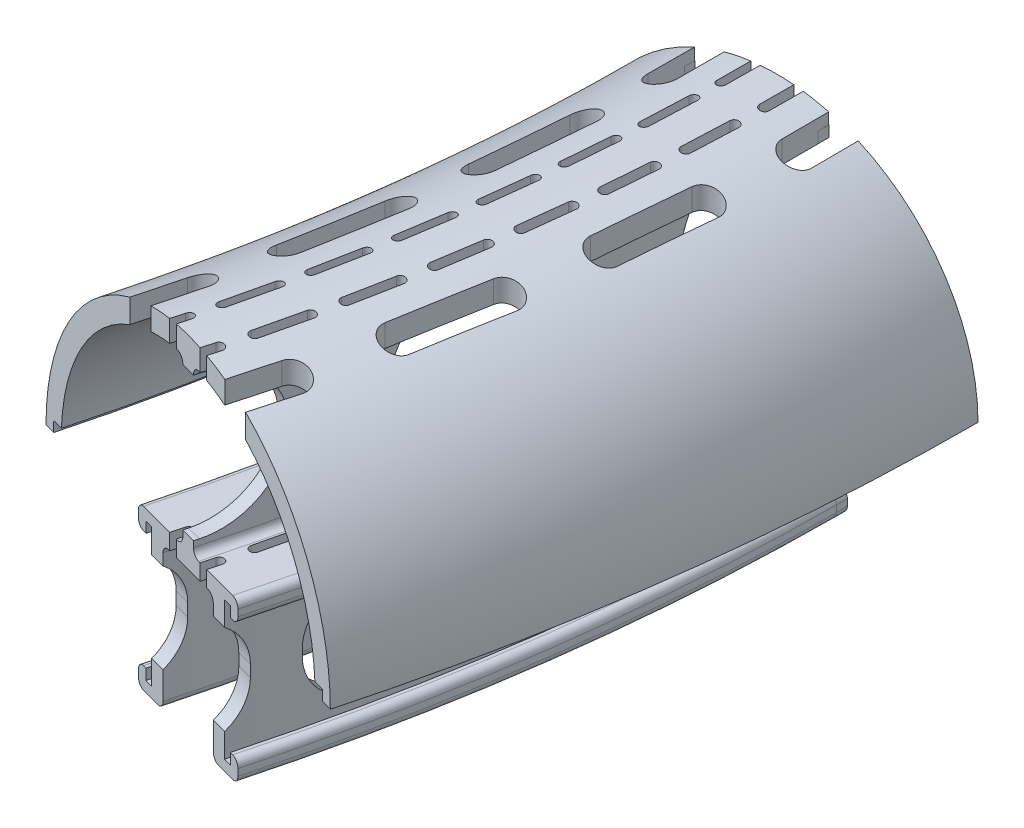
SolidWorks part; units mm, degrees
ref_plane "Спереди" through (0, 0, 0) normal (0, 0, 1) x (1, 0, 0)
ref_plane "Сверху" through (0, 0, 0) normal (0, 1, 0) x (1, 0, 0)
ref_plane "Справа" through (0, 0, 0) normal (1, 0, 0) x (0, 0, -1)
sketch "Эскиз1" plane through (0, 0, 0) normal (0, 0, 1) x (1, 0, 0)
  line L29 (145.55, 0.25) -> (146.15, 0.25)
  line L31 (145.55, -10.05) -> (146.15, -10.05)
  line L33 (145.3, -0.55) -> (145.55, -0.55)
  line L35 (145.3, -9.25) -> (145.55, -9.25)
  line L40 (145.55, 0.25) -> (145.55, -0.55)
  line L46 (144.75, -10.3) -> (144.75, -9.8)
  line L50 (144.75, 0) -> (144.75, 0.5)
  line L51 (145.55, -9.25) -> (145.55, -10.05)
  line L52 (146.15, 0.25) -> (146.15, -10.05)
  line L56 (135.8213, 0.7768) -> (136.6225, 0.7768)
  line L58 (135, 0) -> (135.8, 0)
  line L62 (164.2, 0) -> (165, 0)
  line L63 (163.3775, 0.7768) -> (164.1787, 0.7768)
  line L65 (0, 44.1102) -> (0, 0) construction
  line L68 (149.4347, 12.8015) -> (149.4347, 1.6)
  line L71 (145.3, 1.05) -> (148.8847, 1.05)
  line L72 (147.9, -0.15) -> (152.1, -0.15)
  line L73 (147.35, -0.7) -> (147.35, -10.3)
  line L74 (145.3, -10.85) -> (146.8, -10.85)
  line L75 (150, 12.0049) -> (150, -5.7785) construction
  line L76 (154.7, -10.85) -> (153.2, -10.85)
  line L77 (152.65, -0.7) -> (152.65, -10.3)
  line L78 (154.7, 1.05) -> (151.1153, 1.05)
  line L79 (150.5653, 12.8015) -> (150.5653, 1.6)
  line L80 (153.85, 0.25) -> (153.85, -10.05)
  line L81 (154.45, -9.25) -> (154.45, -10.05)
  line L82 (155.25, 0) -> (155.25, 0.5)
  line L83 (155.25, -10.3) -> (155.25, -9.8)
  line L84 (154.45, 0.25) -> (154.45, -0.55)
  line L85 (154.7, -9.25) -> (154.45, -9.25)
  line L86 (154.7, -0.55) -> (154.45, -0.55)
  line L87 (154.45, -10.05) -> (153.85, -10.05)
  line L88 (154.45, 0.25) -> (153.85, 0.25)
  arc A0 (165, 0) -> (135, 0) centre (150, 0) ccw
  arc A2 (148.837, 13.3494) -> (136.6225, 0.7768) centre (150, 0) ccw
  arc A3 (144.75, 0.5) -> (145.3, 1.05) centre (145.3, 0.5) cw
  arc A4 (145.3, -0.55) -> (144.75, 0) centre (145.3, 0) cw
  arc A7 (145.3, -9.25) -> (144.75, -9.8) centre (145.3, -9.8) ccw
  arc A10 (145.3, -10.85) -> (144.75, -10.3) centre (145.3, -10.3) cw
  arc A15 (163.3775, 0.7768) -> (151.163, 13.3494) centre (150, 0) ccw
  arc A18 (135.8213, 0.7768) -> (135.8, 0) centre (150, 0) ccw
  arc A19 (164.2, 0) -> (164.1787, 0.7768) centre (150, 0) ccw
  arc A20 (164.2, 0) -> (150.6174, 14.1866) centre (150, 0) ccw construction
  arc A21 (163.4, 0) -> (150.5826, 13.3873) centre (150, 0) ccw construction
  arc A22 (149.4174, 13.3873) -> (136.6, 0) centre (150, 0) ccw construction
  arc A23 (149.3826, 14.1866) -> (135.8, 0) centre (150, 0) ccw construction
  arc A24 (148.837, 13.3494) -> (149.4347, 12.8015) centre (148.8847, 12.8015) cw
  arc A25 (150.5653, 12.8015) -> (151.163, 13.3494) centre (151.1153, 12.8015) cw
  arc A28 (147.35, -10.3) -> (146.8, -10.85) centre (146.8, -10.3) cw
  arc A29 (148.8847, 1.05) -> (149.4347, 1.6) centre (148.8847, 1.6) ccw
  arc A30 (147.9, -0.15) -> (147.35, -0.7) centre (147.9, -0.7) ccw
  arc A31 (152.1, -0.15) -> (152.65, -0.7) centre (152.1, -0.7) cw
  arc A32 (151.1153, 1.05) -> (150.5653, 1.6) centre (151.1153, 1.6) cw
  arc A33 (152.65, -10.3) -> (153.2, -10.85) centre (153.2, -10.3) ccw
  arc A34 (154.7, -10.85) -> (155.25, -10.3) centre (154.7, -10.3) ccw
  arc A35 (154.7, -9.25) -> (155.25, -9.8) centre (154.7, -9.8) cw
  arc A36 (154.7, -0.55) -> (155.25, 0) centre (154.7, 0) ccw
  arc A37 (155.25, 0.5) -> (154.7, 1.05) centre (154.7, 0.5) ccw
  point P39 (144.75, -0.55)
  point P58 (146.15, -7.55)
  point P60 (153.85, -7.55)
  point P61 (150, -0.15)
  dimension "D1" = 30
  dimension "D3" = 1.6
  dimension "D13" = 0.8
  dimension "D14" = 4.2
  dimension "D17" = 0.55
  dimension "D4" = 1.2
  dimension "D6" = 0.55
  dimension "D2" = 150
  dimension "D5" = 1.2
  dimension "D7" = 10.3
  dimension "D8" = 0.8
  dimension "D9" = 0.6
  dimension "D10" = 0.8
  dimension "D11" = 0.8
  dimension "D12" = 0.8
  dimension "D15" = 0.8
revolve "Повернуть1" add sketch "Эскиз1" angle 15 about L65
sketch "Эскиз2" plane through (0, 0, 0) normal (0, 0, 1) x (1, 0, 0)
  line L0 (0, 24.166) -> (0, -25.4144) construction
  circle A0 centre (150, 0) radius 14.2
revolve "Вырез-Повернуть1" cut sketch "Эскиз2" angle 0.3 about L0
sketch "Эскиз3" plane through (0, 0, 0) normal (-0.2588, 0, 0.9659) x (0.9659, 0, 0.2588)
  line L0 (0, 58.5351) -> (0, -22.4397) construction
  line L31 (135, 0) -> (135.8, 0)
  line L32 (135.8213, 0.7768) -> (136.6225, 0.7768)
  line L33 (149.4347, 12.8015) -> (149.4347, 1.6)
  line L34 (148.8847, 1.05) -> (145.3, 1.05)
  line L35 (144.75, 0.5) -> (144.75, 0)
  line L36 (145.3, -0.55) -> (145.55, -0.55)
  line L37 (145.55, -0.55) -> (145.55, 0.25)
  line L38 (145.55, 0.25) -> (146.15, 0.25)
  line L39 (146.15, 0.25) -> (146.15, -10.05)
  line L40 (146.15, -10.05) -> (145.55, -10.05)
  line L41 (145.55, -10.05) -> (145.55, -9.25)
  line L42 (145.55, -9.25) -> (145.3, -9.25)
  line L43 (144.75, -9.8) -> (144.75, -10.3)
  line L44 (145.3, -10.85) -> (146.8, -10.85)
  line L45 (147.35, -10.3) -> (147.35, -0.7)
  line L46 (147.9, -0.15) -> (152.1, -0.15)
  line L47 (152.65, -0.7) -> (152.65, -10.3)
  line L48 (153.2, -10.85) -> (154.7, -10.85)
  line L49 (155.25, -10.3) -> (155.25, -9.8)
  line L50 (154.7, -9.25) -> (154.45, -9.25)
  line L51 (154.45, -9.25) -> (154.45, -10.05)
  line L52 (154.45, -10.05) -> (153.85, -10.05)
  line L53 (153.85, -10.05) -> (153.85, 0.25)
  line L54 (153.85, 0.25) -> (154.45, 0.25)
  line L55 (154.45, 0.25) -> (154.45, -0.55)
  line L56 (154.45, -0.55) -> (154.7, -0.55)
  line L57 (155.25, 0) -> (155.25, 0.5)
  line L58 (154.7, 1.05) -> (151.1153, 1.05)
  line L59 (150.5653, 1.6) -> (150.5653, 12.8015)
  line L60 (163.3775, 0.7768) -> (164.1787, 0.7768)
  line L61 (164.2, 0) -> (165, 0)
  line L63 (135.8213, 0.7768) -> (136.6225, 0.7768)
  line L64 (149.4347, 12.8015) -> (149.4347, 1.6)
  line L65 (148.8847, 1.05) -> (145.3, 1.05)
  line L66 (144.75, 0.5) -> (144.75, 0)
  line L67 (145.3, -0.55) -> (145.55, -0.55)
  line L68 (145.55, -0.55) -> (145.55, 0.25)
  line L69 (145.55, 0.25) -> (146.15, 0.25)
  line L70 (146.15, 0.25) -> (146.15, -10.05)
  line L71 (146.15, -10.05) -> (145.55, -10.05)
  line L72 (145.55, -10.05) -> (145.55, -9.25)
  line L73 (145.55, -9.25) -> (145.3, -9.25)
  line L74 (144.75, -9.8) -> (144.75, -10.3)
  line L75 (145.3, -10.85) -> (146.8, -10.85)
  line L76 (147.35, -10.3) -> (147.35, -0.7)
  line L77 (147.9, -0.15) -> (152.1, -0.15)
  line L78 (152.65, -0.7) -> (152.65, -10.3)
  line L79 (153.2, -10.85) -> (154.7, -10.85)
  line L80 (155.25, -10.3) -> (155.25, -9.8)
  line L81 (154.7, -9.25) -> (154.45, -9.25)
  line L82 (154.45, -9.25) -> (154.45, -10.05)
  line L83 (154.45, -10.05) -> (153.85, -10.05)
  line L84 (153.85, -10.05) -> (153.85, 0.25)
  line L85 (153.85, 0.25) -> (154.45, 0.25)
  line L86 (154.45, 0.25) -> (154.45, -0.55)
  line L87 (154.45, -0.55) -> (154.7, -0.55)
  line L88 (155.25, 0) -> (155.25, 0.5)
  line L89 (154.7, 1.05) -> (151.1153, 1.05)
  line L90 (150.5653, 1.6) -> (150.5653, 12.8015)
  line L91 (163.3775, 0.7768) -> (164.1787, 0.7768)
  arc A0 (164.1787, 0.7768) -> (135.8213, 0.7768) centre (150, 0) ccw
  arc A21 (165, 0) -> (135, 0) centre (150, 0) ccw
  arc A22 (135.8213, 0.7768) -> (135.8, 0) centre (150, 0) ccw
  arc A23 (148.837, 13.3494) -> (136.6225, 0.7768) centre (150, 0) ccw
  arc A24 (149.4347, 12.8015) -> (148.837, 13.3494) centre (148.8847, 12.8015) ccw
  arc A25 (148.8847, 1.05) -> (149.4347, 1.6) centre (148.8847, 1.6) ccw
  arc A26 (145.3, 1.05) -> (144.75, 0.5) centre (145.3, 0.5) ccw
  arc A27 (144.75, 0) -> (145.3, -0.55) centre (145.3, 0) ccw
  arc A28 (145.3, -9.25) -> (144.75, -9.8) centre (145.3, -9.8) ccw
  arc A29 (144.75, -10.3) -> (145.3, -10.85) centre (145.3, -10.3) ccw
  arc A30 (146.8, -10.85) -> (147.35, -10.3) centre (146.8, -10.3) ccw
  arc A31 (147.9, -0.15) -> (147.35, -0.7) centre (147.9, -0.7) ccw
  arc A32 (152.65, -0.7) -> (152.1, -0.15) centre (152.1, -0.7) ccw
  arc A33 (152.65, -10.3) -> (153.2, -10.85) centre (153.2, -10.3) ccw
  arc A34 (154.7, -10.85) -> (155.25, -10.3) centre (154.7, -10.3) ccw
  arc A35 (155.25, -9.8) -> (154.7, -9.25) centre (154.7, -9.8) ccw
  arc A36 (154.7, -0.55) -> (155.25, 0) centre (154.7, 0) ccw
  arc A37 (155.25, 0.5) -> (154.7, 1.05) centre (154.7, 0.5) ccw
  arc A38 (150.5653, 1.6) -> (151.1153, 1.05) centre (151.1153, 1.6) ccw
  arc A39 (151.163, 13.3494) -> (150.5653, 12.8015) centre (151.1153, 12.8015) ccw
  arc A40 (163.3775, 0.7768) -> (151.163, 13.3494) centre (150, 0) ccw
  arc A41 (164.2, 0) -> (164.1787, 0.7768) centre (150, 0) ccw
  arc A44 (148.837, 13.3494) -> (136.6225, 0.7768) centre (150, 0) ccw
  arc A45 (149.4347, 12.8015) -> (148.837, 13.3494) centre (148.8847, 12.8015) ccw
  arc A46 (148.8847, 1.05) -> (149.4347, 1.6) centre (148.8847, 1.6) ccw
  arc A47 (145.3, 1.05) -> (144.75, 0.5) centre (145.3, 0.5) ccw
  arc A48 (144.75, 0) -> (145.3, -0.55) centre (145.3, 0) ccw
  arc A49 (145.3, -9.25) -> (144.75, -9.8) centre (145.3, -9.8) ccw
  arc A50 (144.75, -10.3) -> (145.3, -10.85) centre (145.3, -10.3) ccw
  arc A51 (146.8, -10.85) -> (147.35, -10.3) centre (146.8, -10.3) ccw
  arc A52 (147.9, -0.15) -> (147.35, -0.7) centre (147.9, -0.7) ccw
  arc A53 (152.65, -0.7) -> (152.1, -0.15) centre (152.1, -0.7) ccw
  arc A54 (152.65, -10.3) -> (153.2, -10.85) centre (153.2, -10.3) ccw
  arc A55 (154.7, -10.85) -> (155.25, -10.3) centre (154.7, -10.3) ccw
  arc A56 (155.25, -9.8) -> (154.7, -9.25) centre (154.7, -9.8) ccw
  arc A57 (154.7, -0.55) -> (155.25, 0) centre (154.7, 0) ccw
  arc A58 (155.25, 0.5) -> (154.7, 1.05) centre (154.7, 0.5) ccw
  arc A59 (150.5653, 1.6) -> (151.1153, 1.05) centre (151.1153, 1.6) ccw
  arc A60 (151.163, 13.3494) -> (150.5653, 12.8015) centre (151.1153, 12.8015) ccw
  arc A61 (163.3775, 0.7768) -> (151.163, 13.3494) centre (150, 0) ccw
  dimension "D1" = 0
revolve "Повернуть2" add sketch "Эскиз3" angle 0.3 about L0
sketch "Эскиз5" plane through (0, -0.15, 0) normal (0, -1, 0) x (1, 0, 0)
  line L0 (144.0175, 33.6654) -> (144.9764, 33.8895) construction
  line L1 (144.9764, 33.8895) -> (147.1484, 34.3972) construction
  line L2 (147.1484, 34.3972) -> (146.0624, 34.1434) construction
  line L5 (146.0624, 34.1434) -> (146.389, 32.7464) construction
  line L6 (144.0986, 35.4815) -> (144.8953, 32.0734) construction
  line L11 (144.4394, 35.5612) -> (145.2361, 32.1531)
  line L14 (143.7578, 35.4018) -> (144.5545, 31.9937)
  line L15 (147.2295, 36.2134) -> (148.0262, 32.8053) construction
  line L18 (146.8887, 36.1337) -> (147.6854, 32.7256)
  line L21 (147.5703, 36.2931) -> (148.367, 32.8849)
  line L22 (145.1756, 28.2568) -> (146.1422, 28.445) construction
  line L25 (146.1422, 28.445) -> (148.3317, 28.8711) construction
  line L28 (148.3317, 28.8711) -> (147.2369, 28.6581) construction
  line L29 (147.2369, 28.6581) -> (147.511, 27.2499) construction
  line L32 (145.3246, 30.0687) -> (145.9933, 26.6332) construction
  line L35 (145.6681, 30.1355) -> (146.3368, 26.7)
  line L36 (144.981, 30.0018) -> (145.6497, 26.5663)
  line L39 (148.4806, 30.683) -> (149.1493, 27.2474) construction
  line L42 (148.1371, 30.6161) -> (148.8058, 27.1806)
  line L43 (148.8242, 30.7498) -> (149.4929, 27.3143)
  line L46 (146.1307, 22.8088) -> (147.1036, 22.9607) construction
  line L49 (147.1036, 22.9607) -> (149.3075, 23.3047) construction
  line L50 (149.3075, 23.3047) -> (148.2055, 23.1327) construction
  line L53 (148.2055, 23.1327) -> (148.4268, 21.7152) construction
  line L56 (146.3472, 24.6138) -> (146.887, 21.1557) construction
  line L57 (146.6931, 24.6678) -> (147.2328, 21.2096)
  line L60 (146.0014, 24.5598) -> (146.5412, 21.1017)
  line L63 (149.5241, 25.1096) -> (150.0638, 21.6515) construction
  line L64 (149.1782, 25.0557) -> (149.718, 21.5975)
  line L67 (149.8699, 25.1636) -> (150.4096, 21.7055)
  line L70 (142.658, 39.0268) -> (143.6079, 39.2867) construction
  line L71 (142.6712, 40.8447) -> (143.5947, 37.4688) construction
  line L72 (143.0088, 40.9371) -> (143.9323, 37.5611)
  line L73 (142.3336, 40.7524) -> (143.2571, 37.3764)
  line L74 (143.6079, 39.2867) -> (145.7594, 39.8753) construction
  line L75 (145.7594, 39.8753) -> (144.6836, 39.581) construction
  line L76 (144.6836, 39.581) -> (145.0622, 38.1972) construction
  line L77 (145.7725, 41.6931) -> (146.6961, 38.3172) construction
  line L78 (145.4349, 41.6008) -> (146.3585, 38.2248)
  line L79 (146.1101, 41.7855) -> (147.0336, 38.4096)
  line L80 (146.8813, 17.3288) -> (147.8593, 17.4442) construction
  line L81 (147.8593, 17.4442) -> (150.0745, 17.7056) construction
  line L82 (150.0745, 17.7056) -> (148.9669, 17.5749) construction
  line L83 (148.9669, 17.5749) -> (149.1349, 16.1502) construction
  line L84 (147.1652, 19.1245) -> (147.5753, 15.6486) construction
  line L87 (147.5128, 19.1655) -> (147.9229, 15.6896)
  line L90 (146.8177, 19.0835) -> (147.2277, 15.6076)
  line L91 (150.3584, 19.5012) -> (150.7685, 16.0253) construction
  line L92 (150.0108, 19.4602) -> (150.4209, 15.9843)
  line L93 (150.706, 19.5422) -> (151.1161, 16.0663)
  line L94 (147.4265, 11.8247) -> (148.4081, 11.9034) construction
  line L97 (148.4081, 11.9034) -> (150.6315, 12.0817) construction
  line L100 (150.6315, 12.0817) -> (149.5198, 11.9926) construction
  line L101 (149.5198, 11.9926) -> (149.6345, 10.5625) construction
  line L102 (147.7774, 13.6084) -> (148.0572, 10.1196) construction
  line L103 (148.1263, 13.6364) -> (148.4061, 10.1476)
  line L104 (147.4285, 13.5804) -> (147.7084, 10.0916)
  line L107 (150.9824, 13.8655) -> (151.2622, 10.3767) construction
  line L110 (150.6335, 13.8375) -> (150.9134, 10.3487)
  line L111 (151.3313, 13.8935) -> (151.6111, 10.4047)
  line L112 (147.7656, 6.3039) -> (148.7494, 6.3459) construction
  line L113 (148.7494, 6.3459) -> (150.978, 6.441) construction
  line L114 (150.978, 6.441) -> (149.8637, 6.3934) construction
  line L117 (149.8637, 6.3934) -> (149.9248, 4.9601) construction
  line L120 (148.1829, 8.0733) -> (148.3321, 4.5765) construction
  line L121 (148.5326, 8.0883) -> (148.6818, 4.5914)
  line L122 (147.8332, 8.0584) -> (147.9824, 4.5616)
  line L123 (151.3953, 8.2104) -> (151.5445, 4.7136) construction
  line L124 (151.0456, 8.1955) -> (151.1948, 4.6986)
  line L127 (151.745, 8.2253) -> (151.8941, 4.7285)
  line L130 (147.898, 0.7744) -> (148.8827, 0.7796) construction
  line L131 (148.8827, 0.7796) -> (151.1132, 0.7912) construction
  line L132 (151.1132, 0.7912) -> (149.9979, 0.7854) construction
  line L133 (149.9979, 0.7854) -> (150.0055, -0.6492) construction
  line L134 (148.3812, 2.527) -> (148.3995, -0.973) construction
  line L137 (148.7312, 2.5288) -> (148.7495, -0.9712)
  line L140 (148.0312, 2.5251) -> (148.0495, -0.9748)
  line L141 (151.5964, 2.5438) -> (151.6147, -0.9562) construction
  line L142 (151.2464, 2.542) -> (151.2647, -0.958)
  line L143 (151.9464, 2.5456) -> (151.9647, -0.9543)
  arc A40 (152.0979, 0.7964) -> (146.7092, 40.1351) centre (0, 0) ccw construction
  arc A41 (147.898, 0.7744) -> (142.658, 39.0268) centre (0, 0) ccw construction
  arc A42 (152.0979, 0.7964) -> (146.7092, 40.1351) centre (0, 0) ccw construction
  arc A43 (147.898, 0.7744) -> (142.658, 39.0268) centre (0, 0) ccw construction
  arc A44 (151.1132, 0.7912) -> (145.7594, 39.8753) centre (0, 0) ccw construction
  arc A45 (148.8827, 0.7796) -> (143.6079, 39.2867) centre (0, 0) ccw construction
  arc A46 (151.1132, 0.7912) -> (145.7594, 39.8753) centre (0, 0) ccw construction
  arc A47 (148.8827, 0.7796) -> (143.6079, 39.2867) centre (0, 0) ccw construction
  arc A48 (143.0088, 40.9371) -> (142.3336, 40.7524) centre (142.6712, 40.8447) ccw
  arc A49 (143.2571, 37.3764) -> (143.9323, 37.5611) centre (143.5947, 37.4688) ccw
  arc A50 (145.4349, 41.6008) -> (146.1101, 41.7855) centre (145.7725, 41.6931) cw
  arc A51 (147.0336, 38.4096) -> (146.3585, 38.2248) centre (146.6961, 38.3172) cw
  arc A84 (144.4394, 35.5612) -> (143.7578, 35.4018) centre (144.0986, 35.4815) ccw
  arc A85 (144.5545, 31.9937) -> (145.2361, 32.1531) centre (144.8953, 32.0734) ccw
  arc A86 (146.8887, 36.1337) -> (147.5703, 36.2931) centre (147.2295, 36.2134) cw
  arc A87 (148.367, 32.8849) -> (147.6854, 32.7256) centre (148.0262, 32.8053) cw
  arc A88 (145.6681, 30.1355) -> (144.981, 30.0018) centre (145.3246, 30.0687) ccw
  arc A89 (145.6497, 26.5663) -> (146.3368, 26.7) centre (145.9933, 26.6332) ccw
  arc A90 (148.1371, 30.6161) -> (148.8242, 30.7498) centre (148.4806, 30.683) cw
  arc A91 (149.4929, 27.3143) -> (148.8058, 27.1806) centre (149.1493, 27.2474) cw
  arc A92 (146.6931, 24.6678) -> (146.0014, 24.5598) centre (146.3472, 24.6138) ccw
  arc A93 (146.5412, 21.1017) -> (147.2328, 21.2096) centre (146.887, 21.1557) ccw
  arc A94 (149.1782, 25.0557) -> (149.8699, 25.1636) centre (149.5241, 25.1096) cw
  arc A95 (150.4096, 21.7055) -> (149.718, 21.5975) centre (150.0638, 21.6515) cw
  arc A96 (147.5128, 19.1655) -> (146.8177, 19.0835) centre (147.1652, 19.1245) ccw
  arc A97 (147.2277, 15.6076) -> (147.9229, 15.6896) centre (147.5753, 15.6486) ccw
  arc A98 (150.0108, 19.4602) -> (150.706, 19.5422) centre (150.3584, 19.5012) cw
  arc A99 (151.1161, 16.0663) -> (150.4209, 15.9843) centre (150.7685, 16.0253) cw
  arc A100 (148.1263, 13.6364) -> (147.4285, 13.5804) centre (147.7774, 13.6084) ccw
  arc A101 (147.7084, 10.0916) -> (148.4061, 10.1476) centre (148.0572, 10.1196) ccw
  arc A102 (150.6335, 13.8375) -> (151.3313, 13.8935) centre (150.9824, 13.8655) cw
  arc A103 (151.6111, 10.4047) -> (150.9134, 10.3487) centre (151.2622, 10.3767) cw
  arc A104 (148.5326, 8.0883) -> (147.8332, 8.0584) centre (148.1829, 8.0733) ccw
  arc A105 (147.9824, 4.5616) -> (148.6818, 4.5914) centre (148.3321, 4.5765) ccw
  arc A106 (151.0456, 8.1955) -> (151.745, 8.2253) centre (151.3953, 8.2104) cw
  arc A107 (151.8941, 4.7285) -> (151.1948, 4.6986) centre (151.5445, 4.7136) cw
  arc A108 (148.7312, 2.5288) -> (148.0312, 2.5251) centre (148.3812, 2.527) ccw
  arc A109 (148.0495, -0.9748) -> (148.7495, -0.9712) centre (148.3995, -0.973) ccw
  arc A110 (151.2464, 2.542) -> (151.9464, 2.5456) centre (151.5964, 2.5438) cw
  arc A111 (151.9647, -0.9543) -> (151.2647, -0.958) centre (151.6147, -0.9562) cw
  point P4 (197.2189, 41.8003)
  point P11 (144.497, 33.7775)
  point P20 (147.6279, 34.5093)
  point P24 (195.9197, 47.5186)
  point P29 (198.3512, 36.0465)
  point P32 (145.6589, 28.3509)
  point P36 (199.3157, 30.2623)
  point P42 (148.815, 28.9652)
  point P45 (200.1116, 24.4524)
  point P52 (200.7381, 18.6219)
  point P54 (146.6171, 22.8847)
  point P61 (201.1948, 12.7756)
  point P64 (149.7939, 23.3806)
  point P68 (201.4812, 6.9185)
  point P75 (147.3703, 17.3865)
  point P77 (201.5972, 1.0556)
  point P85 (150.5634, 17.7633)
  point P95 (147.9173, 11.864)
  point P104 (151.1223, 12.1211)
  point P114 (148.2575, 6.3249)
  point P123 (151.4699, 6.462)
  point P133 (148.3903, 0.777)
  point P142 (151.6056, 0.7938)
  point P147 (0, 0)
  point P162 (0, 0)
  point P175 (143.133, 39.1567)
  point P180 (143.133, 39.1567)
  point P185 (146.2343, 40.0052)
  point P344 (152.9355, -0.3433)
  dimension "D4" = 3.5
  dimension "D5" = 0.7
  dimension "D6" = 0
extrude "Вырез-Вытянуть1" cut sketch "Эскиз5" against normal blind 20
ref_plane "Плоскость1" through (0, 2.05, 0) normal (0, 1, 0) x (1, 0, 0)
sketch "Эскиз6" plane through (0, 2.05, 0) normal (0, 1, 0) x (1, 0, 0)
  line L9 (150.6637, -0.6889) -> (149.3332, -0.6819)
  line L14 (150.4756, -7.5578) -> (149.1467, -7.4919)
  line L17 (144.0155, -39.5019) -> (145.2989, -39.853)
  line L18 (150.5632, -0.7884) -> (149.4327, -0.7824) construction
  line L19 (144.1384, -39.4318) -> (145.2289, -39.7301) construction
  line L20 (146.9649, -33.1865) -> (145.6672, -32.8926)
  line L21 (146.8453, -33.2619) -> (145.7427, -33.0122) construction
  line L22 (148.1214, -27.0178) -> (147.0092, -26.815) construction
  line L23 (149.9306, -13.8102) -> (148.8048, -13.7065) construction
  line L24 (150.3807, -7.453) -> (149.2515, -7.397) construction
  line L25 (148.2018, -27.1341) -> (146.8928, -26.8954)
  line L26 (150.0393, -13.7198) -> (148.7144, -13.5978)
  arc A24 (145.2289, -39.7301) -> (150.5632, -0.7884) centre (0, 0) ccw construction
  arc A25 (144.1384, -39.4318) -> (149.4327, -0.7824) centre (0, 0) ccw construction
  arc A26 (145.2289, -39.7301) -> (146.8453, -33.2619) centre (0, 0) ccw construction
  arc A27 (144.1384, -39.4318) -> (145.7427, -33.0122) centre (0, 0) ccw construction
  arc A28 (150.3807, -7.453) -> (150.5632, -0.7884) centre (0, 0) ccw construction
  arc A29 (149.2515, -7.397) -> (149.4327, -0.7824) centre (0, 0) ccw construction
  arc A30 (148.1214, -27.0178) -> (149.9306, -13.8102) centre (0, 0) ccw construction
  arc A31 (147.0092, -26.815) -> (148.8048, -13.7065) centre (0, 0) ccw construction
  arc A32 (149.1467, -7.4919) -> (149.3332, -0.6819) centre (0, 0) ccw
  arc A33 (150.4756, -7.5578) -> (150.6637, -0.6889) centre (0, 0) ccw
  arc A36 (145.2989, -39.853) -> (146.9649, -33.1865) centre (0, 0) ccw
  arc A37 (144.0155, -39.5019) -> (145.6672, -32.8926) centre (0, 0) ccw
  arc A38 (146.8928, -26.8954) -> (148.7144, -13.5978) centre (0, 0) ccw
  arc A39 (148.2018, -27.1341) -> (150.0393, -13.7198) centre (0, 0) ccw
  point P18 (0, 0)
  point P29 (0, 0)
  dimension "D1" = 0.1
extrude "Вырез-Вытянуть3" cut sketch "Эскиз6" along normal blind 10.7
fillet "Скругление1" radius 5.6 8 edges at (147.5473, 12.75, 27.0148) (149.8111, 12.75, 7.5249) (149.8111, 2.05, 7.5249) (147.5473, 2.05, 27.0148) (149.3768, 2.05, 13.6588) (146.3161, 2.05, 33.0395) (149.3768, 12.75, 13.6588) (146.3161, 12.75, 33.0395)
ref_plane "Плоскость2" through (0, -1.15, 0) normal (0, -1, 0) x (-1, 0, 0)
sketch "Эскиз8" plane through (0, -1.15, 0) normal (0, -1, 0) x (-1, 0, 0)
  line L48 (-146.2207, -2.9255) -> (-147.2205, -2.9461) construction
  line L53 (-146.1187, -3.0234) -> (-147.3185, -3.0482)
  line L54 (-153.7134, -6.4819) -> (-152.5145, -6.4313) construction
  line L55 (-153.4397, -11.2285) -> (-152.2429, -11.1409) construction
  line L56 (-153.1635, -14.5177) -> (-151.9689, -14.4045) construction
  line L57 (-152.6418, -19.2431) -> (-151.4512, -19.093) construction
  line L58 (-152.1939, -22.5132) -> (-151.0068, -22.3376) construction
  line L59 (-151.4256, -27.2048) -> (-150.2445, -26.9926) construction
  line L60 (-150.8069, -30.4481) -> (-149.6307, -30.2107) construction
  line L61 (-149.7941, -35.0935) -> (-148.6257, -34.8198) construction
  line L62 (-149.0072, -38.2973) -> (-147.845, -37.9984)
  line L63 (-0.6832, -0.1601) -> (-0.1526, -0.0145)
  line L64 (-0.4482, -0.0905) -> (0, 0)
  line L65 (-1.0818, -0.2534) -> (0, 0)
  line L66 (-1.0818, -0.2534) -> (-0.1526, -0.0145)
  line L67 (-152.6173, -3.1578) -> (-153.8171, -3.1827)
  line L68 (-147.2192, -6.208) -> (-146.0202, -6.1575) construction
  line L69 (-146.957, -10.7541) -> (-145.7602, -10.6665) construction
  line L70 (-146.6925, -13.9044) -> (-145.4979, -13.7911) construction
  line L71 (-146.1929, -18.4299) -> (-145.0023, -18.2798) construction
  line L72 (-145.7639, -21.5617) -> (-144.5768, -21.3861) construction
  line L73 (-145.0281, -26.0549) -> (-143.8471, -25.8426) construction
  line L74 (-144.4355, -29.1617) -> (-143.2592, -28.9243) construction
  line L75 (-143.4655, -33.6108) -> (-142.2971, -33.3371) construction
  line L76 (-142.712, -36.6783) -> (-141.5498, -36.3794)
  line L77 (-153.8175, -6.3862) -> (-152.4187, -6.3272)
  line L78 (-153.5321, -11.3355) -> (-152.1358, -11.2333)
  line L79 (-153.2725, -14.4276) -> (-151.8787, -14.2955)
  line L80 (-152.7285, -19.3549) -> (-151.3395, -19.1797)
  line L81 (-152.3074, -22.4289) -> (-150.9225, -22.224)
  line L82 (-151.5063, -27.321) -> (-150.1284, -27.0733)
  line L83 (-150.9247, -30.3699) -> (-149.5524, -30.0928)
  line L84 (-149.8686, -35.2136) -> (-148.5055, -34.8943)
  line L85 (-148.8854, -38.3693) -> (-147.9169, -38.1202) construction
  line L86 (-152.7193, -3.0599) -> (-153.7191, -3.0806) construction
  line L87 (-147.3233, -6.1123) -> (-145.9245, -6.0533)
  line L88 (-147.0494, -10.8611) -> (-145.6532, -10.7589)
  line L89 (-146.8015, -13.8143) -> (-145.4077, -13.6821)
  line L90 (-146.2796, -18.5417) -> (-144.8906, -18.3665)
  line L91 (-145.8774, -21.4774) -> (-144.4925, -21.2725)
  line L92 (-145.1089, -26.171) -> (-143.7309, -25.9234)
  line L93 (-144.5533, -29.0835) -> (-143.181, -28.8064)
  line L94 (-143.54, -33.731) -> (-142.1769, -33.4116)
  line L95 (-142.5903, -36.7503) -> (-141.6218, -36.5012) construction
  line L96 (-146.148, -0.7652) -> (-153.8479, -0.8056)
  line L97 (-140.9701, -38.565) -> (-148.3972, -40.5969)
  arc A44 (-152.6479, -0.7993) -> (-147.2397, -40.2802) centre (0, 0) ccw construction
  arc A53 (-153.8479, -0.8056) -> (-148.3972, -40.5969) centre (0, 0) ccw construction
  arc A54 (-147.348, -0.7715) -> (-142.1275, -38.8817) centre (0, 0) ccw construction
  arc A55 (-146.148, -0.7652) -> (-140.9701, -38.565) centre (0, 0) ccw construction
  arc A56 (-152.6479, -0.7993) -> (-152.6173, -3.1578) centre (0, 0) ccw
  arc A57 (-153.8479, -0.8056) -> (-153.8171, -3.1827) centre (0, 0) ccw
  arc A58 (-147.348, -0.7715) -> (-147.3185, -3.0482) centre (0, 0) ccw
  arc A59 (-146.148, -0.7652) -> (-146.1187, -3.0234) centre (0, 0) ccw
  arc A60 (-146.0202, -6.1575) -> (-145.7602, -10.6665) centre (0, 0) ccw construction
  arc A61 (-147.2192, -6.208) -> (-146.957, -10.7541) centre (0, 0) ccw construction
  arc A62 (-152.5145, -6.4313) -> (-152.2429, -11.1409) centre (0, 0) ccw construction
  arc A63 (-153.7134, -6.4819) -> (-153.4397, -11.2285) centre (0, 0) ccw construction
  arc A64 (-145.4979, -13.7911) -> (-145.0023, -18.2798) centre (0, 0) ccw construction
  arc A65 (-146.6925, -13.9044) -> (-146.1929, -18.4299) centre (0, 0) ccw construction
  arc A66 (-151.9689, -14.4045) -> (-151.4512, -19.093) centre (0, 0) ccw construction
  arc A67 (-153.1635, -14.5177) -> (-152.6418, -19.2431) centre (0, 0) ccw construction
  arc A68 (-144.5768, -21.3861) -> (-143.8471, -25.8426) centre (0, 0) ccw construction
  arc A69 (-145.7639, -21.5617) -> (-145.0281, -26.0549) centre (0, 0) ccw construction
  arc A70 (-151.0068, -22.3376) -> (-150.2445, -26.9926) centre (0, 0) ccw construction
  arc A71 (-152.1939, -22.5132) -> (-151.4256, -27.2048) centre (0, 0) ccw construction
  arc A72 (-143.2592, -28.9243) -> (-142.2971, -33.3371) centre (0, 0) ccw construction
  arc A73 (-144.4355, -29.1617) -> (-143.4655, -33.6108) centre (0, 0) ccw construction
  arc A74 (-149.6307, -30.2107) -> (-148.6257, -34.8198) centre (0, 0) ccw construction
  arc A75 (-150.8069, -30.4481) -> (-149.7941, -35.0935) centre (0, 0) ccw construction
  arc A76 (-141.5498, -36.3794) -> (-140.9701, -38.565) centre (0, 0) ccw
  arc A77 (-142.712, -36.6783) -> (-142.1275, -38.8817) centre (0, 0) ccw
  arc A78 (-147.845, -37.9984) -> (-147.2397, -40.2802) centre (0, 0) ccw
  arc A79 (-149.0072, -38.2973) -> (-148.3972, -40.5969) centre (0, 0) ccw
  arc A80 (-146.248, -0.7658) -> (-146.2207, -2.9255) centre (0, 0) ccw construction
  arc A81 (-147.248, -0.771) -> (-147.2205, -2.9461) centre (0, 0) ccw construction
  arc A82 (-152.4187, -6.3272) -> (-152.1358, -11.2333) centre (0, 0) ccw
  arc A83 (-153.8175, -6.3862) -> (-153.5321, -11.3355) centre (0, 0) ccw
  arc A84 (-151.8787, -14.2955) -> (-151.3395, -19.1797) centre (0, 0) ccw
  arc A85 (-153.2725, -14.4276) -> (-152.7285, -19.3549) centre (0, 0) ccw
  arc A86 (-150.9225, -22.224) -> (-150.1284, -27.0733) centre (0, 0) ccw
  arc A87 (-152.3074, -22.4289) -> (-151.5063, -27.321) centre (0, 0) ccw
  arc A88 (-149.5524, -30.0928) -> (-148.5055, -34.8943) centre (0, 0) ccw
  arc A89 (-150.9247, -30.3699) -> (-149.8686, -35.2136) centre (0, 0) ccw
  arc A90 (-148.8854, -38.3693) -> (-148.3007, -40.5705) centre (0, 0) ccw construction
  arc A91 (-147.9169, -38.1202) -> (-147.3361, -40.3066) centre (0, 0) ccw construction
  arc A92 (-152.7479, -0.7998) -> (-152.7193, -3.0599) centre (0, 0) ccw construction
  arc A93 (-153.7479, -0.805) -> (-153.7191, -3.0806) centre (0, 0) ccw construction
  arc A94 (-145.9245, -6.0533) -> (-145.6532, -10.7589) centre (0, 0) ccw
  arc A95 (-147.3233, -6.1123) -> (-147.0494, -10.8611) centre (0, 0) ccw
  arc A96 (-145.4077, -13.6821) -> (-144.8906, -18.3665) centre (0, 0) ccw
  arc A97 (-146.8015, -13.8143) -> (-146.2796, -18.5417) centre (0, 0) ccw
  arc A98 (-144.4925, -21.2725) -> (-143.7309, -25.9234) centre (0, 0) ccw
  arc A99 (-145.8774, -21.4774) -> (-145.1089, -26.171) centre (0, 0) ccw
  arc A100 (-143.181, -28.8064) -> (-142.1769, -33.4116) centre (0, 0) ccw
  arc A101 (-144.5533, -29.0835) -> (-143.54, -33.731) centre (0, 0) ccw
  arc A102 (-142.5903, -36.7503) -> (-142.0311, -38.8553) centre (0, 0) ccw construction
  arc A103 (-141.6218, -36.5012) -> (-141.0665, -38.5914) centre (0, 0) ccw construction
  point P54 (0, 0)
  dimension "D1" = 0.1
extrude "Вырез-Вытянуть4" cut sketch "Эскиз8" along normal blind 7.5 contours L76 A77 L97 A76 | L62 A79 L97 A78 | L83 A89 L84 A88 | L93 A101 L94 A100 | L91 A99 L92 A98 | L81 A87 L82 A86 | L79 A85 L80 A84 | L89 A97 L90 A96 | L87 A95 L88 A94 | L77 A83 L78 A82 | L96 A57 L67 A56 | A59 L96 A58 L53
fillet "Скругление2" radius 3.5 40 edges at (142.8584, -8.65, 33.5713) (143.8671, -1.15, 28.945) (153.1181, -1.15, 6.3567) (152.5756, -1.15, 14.3616) (146.6239, -1.15, 6.0828) (146.1046, -1.15, 13.7482) (145.185, -1.15, 21.375) (151.6149, -1.15, 22.3265) (150.2386, -1.15, 30.2314) (148.4261, -1.15, 38.1479) (142.1309, -1.15, 36.5289) (146.6239, -8.65, 6.0828) (146.1046, -8.65, 13.7482) (145.185, -8.65, 21.375) (153.1181, -8.65, 6.3567) (152.5756, -8.65, 14.3616) (151.6149, -8.65, 22.3265) (150.2386, -8.65, 30.2314) (142.1309, -8.65, 36.5289) (143.8671, -8.65, 28.945) (148.4261, -8.65, 38.1479) (149.1871, -8.65, 35.054) (150.8174, -8.65, 27.1971) (152.034, -8.65, 19.2673) (152.834, -8.65, 11.2844) (153.2172, -8.65, 3.1702) (144.4199, -8.65, 26.0472) (145.5851, -8.65, 18.4541) (146.3513, -8.65, 10.81) (146.7186, -8.65, 3.0358) (142.8584, -1.15, 33.5713) (149.1871, -1.15, 35.054) (150.8174, -1.15, 27.1971) (144.4199, -1.15, 26.0472) (146.3513, -1.15, 10.81) (145.5851, -1.15, 18.4541) (152.034, -1.15, 19.2673) (152.834, -1.15, 11.2844) (153.2172, -1.15, 3.1702) (146.7186, -1.15, 3.0358)
sketch "Эскиз9" plane through (0, 2.05, 0) normal (0, 1, 0) x (1, 0, 0)
  line L0 (149.9632, -0.7852) -> (149.9632, 1.6988) construction
  line L4 (154.9632, 3.5) -> (154.9632, -3.5) construction
  line L5 (153.8632, 3.5) -> (153.8632, -3.5)
  line L8 (156.0632, 3.5) -> (156.0632, -3.5)
  line L9 (149.3241, -13.8524) -> (149.5406, -11.3779) construction
  line L12 (144.7166, -9.1477) -> (144.1066, -16.1211) construction
  line L22 (145.8125, -9.2436) -> (145.2024, -16.2169)
  line L23 (143.6208, -9.0518) -> (143.0107, -16.0252)
  line L26 (154.6786, -10.0193) -> (154.0685, -16.9926) construction
  line L36 (144.9632, 3.5) -> (144.9632, -3.5) construction
  line L37 (146.0632, 3.5) -> (146.0632, -3.5)
  line L38 (143.8632, 3.5) -> (143.8632, -3.5)
  line L40 (153.5828, -9.9234) -> (152.9727, -16.8967)
  line L42 (155.7744, -10.1151) -> (155.1643, -17.0885)
  line L45 (147.5486, -26.8141) -> (147.9799, -24.3679) construction
  line L46 (143.3687, -21.7258) -> (142.1531, -28.6194) construction
  line L49 (144.452, -21.9168) -> (143.2364, -28.8104)
  line L52 (142.2854, -21.5348) -> (141.0699, -28.4284)
  line L53 (153.2168, -23.4623) -> (152.0012, -30.3559) construction
  line L56 (152.1335, -23.2712) -> (150.9179, -30.1649)
  line L59 (154.3, -23.6533) -> (153.0845, -30.5469)
  line L66 (144.6501, -39.5718) -> (145.293, -37.1725) construction
  line L70 (140.9296, -34.1385) -> (139.1179, -40.9) construction
  line L73 (141.9921, -34.4232) -> (140.1804, -41.1847)
  line L74 (139.8671, -33.8538) -> (138.0553, -40.6153)
  line L75 (150.5889, -36.7267) -> (148.7771, -43.4882) construction
  line L76 (149.5263, -36.442) -> (147.7146, -43.2035)
  line L77 (151.6514, -37.0114) -> (149.8396, -43.7729)
  arc A20 (144.1384, -39.4318) -> (149.4327, -0.7824) centre (0, 0) ccw construction
  arc A21 (144.1384, -39.4318) -> (149.4327, -0.7824) centre (0, 0) ccw construction
  arc A22 (145.2289, -39.7301) -> (150.5632, -0.7884) centre (0, 0) ccw construction
  arc A23 (145.2289, -39.7301) -> (150.5632, -0.7884) centre (0, 0) ccw construction
  arc A24 (144.6501, -39.5718) -> (149.9632, -0.7852) centre (0, 0) ccw construction
  arc A25 (146.0632, 3.5) -> (143.8632, 3.5) centre (144.9632, 3.5) ccw
  arc A26 (143.8632, -3.5) -> (146.0632, -3.5) centre (144.9632, -3.5) ccw
  arc A45 (153.8632, 3.5) -> (156.0632, 3.5) centre (154.9632, 3.5) cw
  arc A46 (156.0632, -3.5) -> (153.8632, -3.5) centre (154.9632, -3.5) cw
  arc A47 (145.8125, -9.2436) -> (143.6208, -9.0518) centre (144.7166, -9.1477) ccw
  arc A48 (143.0107, -16.0252) -> (145.2024, -16.2169) centre (144.1066, -16.1211) ccw
  arc A51 (153.5828, -9.9234) -> (155.7744, -10.1151) centre (154.6786, -10.0193) cw
  arc A52 (155.1643, -17.0885) -> (152.9727, -16.8967) centre (154.0685, -16.9926) cw
  arc A55 (144.452, -21.9168) -> (142.2854, -21.5348) centre (143.3687, -21.7258) ccw
  arc A56 (141.0699, -28.4284) -> (143.2364, -28.8104) centre (142.1531, -28.6194) ccw
  arc A59 (152.1335, -23.2712) -> (154.3, -23.6533) centre (153.2168, -23.4623) cw
  arc A60 (153.0845, -30.5469) -> (150.9179, -30.1649) centre (152.0012, -30.3559) cw
  arc A61 (141.9921, -34.4232) -> (139.8671, -33.8538) centre (140.9296, -34.1385) ccw
  arc A62 (138.0553, -40.6153) -> (140.1804, -41.1847) centre (139.1179, -40.9) ccw
  arc A63 (149.5263, -36.442) -> (151.6514, -37.0114) centre (150.5889, -36.7267) cw
  arc A64 (149.8396, -43.7729) -> (147.7146, -43.2035) centre (148.7771, -43.4882) cw
  point P3 (154.9632, 0)
  point P16 (135.5166, -17.7176)
  point P24 (154.3735, -13.5059)
  point P33 (138.9384, -27.073)
  point P39 (144.4116, -12.6344)
  point P47 (141.5844, -36.6767)
  point P54 (152.609, -26.9091)
  point P62 (142.7609, -25.1726)
  point P70 (149.683, -40.1074)
  point P78 (140.0237, -37.5192)
  point P83 (0, 0)
  point P85 (0, 0)
  point P94 (144.9632, 0)
  point P178 (22.9205, -64.2041)
  dimension "D5" = 7
  dimension "D7" = 5
  dimension "D8" = 2.2
extrude "Вырез-Вытянуть5" cut sketch "Эскиз9" along normal blind 20
sketch "Эскиз12" plane through (0, 0, 0) normal (0.0052, 0, -1) x (-1, 0, -0.0052)
  line L0 (-143.8652, 12.8064) -> (-143.8652, 11.9132) construction
  line L1 (-136.6225, 0.7768) -> (-135.8213, 0.7768) construction
  line L2 (-146.0652, 12.8093) -> (-146.0652, 13.644) construction
  line L3 (-148.0424, 14.0644) -> (-148.0424, 13.2562) construction
  line L4 (-150.5653, 12.8015) -> (-150.5653, 12.75) construction
  line L5 (-150.5653, 12.75) -> (-149.4347, 12.75) construction
  line L6 (-149.4347, 12.75) -> (-149.4347, 12.8015) construction
  line L7 (-148.7424, 13.3409) -> (-148.7424, 14.1442) construction
  line L8 (-151.2576, 14.1442) -> (-151.2576, 13.3409) construction
  line L9 (-153.8653, 13.6638) -> (-153.8653, 12.8304) construction
  line L10 (-151.9576, 13.2562) -> (-151.9576, 14.0644) construction
  line L11 (-156.0654, 11.9487) -> (-156.0654, 12.8394) construction
  line L12 (-164.1787, 0.7768) -> (-163.3775, 0.7768) construction
  line L13 (-152.65, -10.3) -> (-152.65, -8.65) construction
  line L14 (-152.65, -8.65) -> (-153.85, -8.65) construction
  line L15 (-153.85, -8.65) -> (-153.85, -10.05) construction
  line L16 (-153.85, -10.05) -> (-154.45, -10.05) construction
  line L17 (-154.45, -10.05) -> (-154.45, -9.25) construction
  line L18 (-154.45, -9.25) -> (-154.7, -9.25) construction
  line L19 (-155.25, -9.8) -> (-155.25, -10.3) construction
  line L20 (-154.7, -10.85) -> (-153.2, -10.85) construction
  line L21 (-146.15, -10.05) -> (-146.15, -8.65) construction
  line L22 (-146.15, -8.65) -> (-147.35, -8.65) construction
  line L23 (-147.35, -8.65) -> (-147.35, -10.3) construction
  line L24 (-146.8, -10.85) -> (-145.3, -10.85) construction
  line L25 (-144.75, -10.3) -> (-144.75, -9.8) construction
  line L26 (-145.3, -9.25) -> (-145.55, -9.25) construction
  line L27 (-145.55, -9.25) -> (-145.55, -10.05) construction
  line L28 (-145.55, -10.05) -> (-146.15, -10.05) construction
  line L29 (-147.35, -1.15) -> (-146.15, -1.15) construction
  line L30 (-146.15, -1.15) -> (-146.15, 0.25) construction
  line L31 (-146.15, 0.25) -> (-145.55, 0.25) construction
  line L32 (-145.55, 0.25) -> (-145.55, -0.55) construction
  line L33 (-145.55, -0.55) -> (-145.3, -0.55) construction
  line L34 (-144.75, 0) -> (-144.75, 0.5) construction
  line L35 (-145.3, 1.05) -> (-148.0424, 1.05) construction
  line L36 (-148.0424, 1.05) -> (-148.0424, -0.15) construction
  line L37 (-148.0424, -0.15) -> (-147.9, -0.15) construction
  line L38 (-147.35, -0.7) -> (-147.35, -1.15) construction
  line L39 (-153.85, -1.15) -> (-152.65, -1.15) construction
  line L40 (-152.65, -1.15) -> (-152.65, -0.7) construction
  line L41 (-152.1, -0.15) -> (-151.9576, -0.15) construction
  line L42 (-151.9576, -0.15) -> (-151.9576, 1.05) construction
  line L43 (-151.9576, 1.05) -> (-154.7, 1.05) construction
  line L44 (-155.25, 0.5) -> (-155.25, 0) construction
  line L45 (-154.7, -0.55) -> (-154.45, -0.55) construction
  line L46 (-154.45, -0.55) -> (-154.45, 0.25) construction
  line L47 (-154.45, 0.25) -> (-153.85, 0.25) construction
  line L48 (-153.85, 0.25) -> (-153.85, -1.15) construction
  line L49 (-149.4347, 2.05) -> (-150.5653, 2.05) construction
  line L50 (-150.5653, 2.05) -> (-150.5653, 1.6) construction
  line L51 (-151.1153, 1.05) -> (-151.2576, 1.05) construction
  line L52 (-151.2576, 1.05) -> (-151.2576, -0.15) construction
  line L53 (-151.2576, -0.15) -> (-148.7424, -0.15) construction
  line L54 (-148.7424, -0.15) -> (-148.7424, 1.05) construction
  line L55 (-148.7424, 1.05) -> (-148.8847, 1.05) construction
  line L56 (-149.4347, 1.6) -> (-149.4347, 2.05) construction
  line L57 (-143.8652, 12.8064) -> (-143.8652, 11.9132)
  line L58 (-136.6225, 0.7768) -> (-135.8213, 0.7768)
  line L59 (-146.0652, 12.8093) -> (-146.0652, 13.644)
  line L60 (-148.0424, 14.0644) -> (-148.0424, 13.2562)
  line L61 (-150.5653, 12.8015) -> (-150.5653, 12.75)
  line L62 (-150.5653, 12.75) -> (-149.4347, 12.75)
  line L63 (-149.4347, 12.75) -> (-149.4347, 12.8015)
  line L64 (-148.7424, 13.3409) -> (-148.7424, 14.1442)
  line L65 (-151.2576, 14.1442) -> (-151.2576, 13.3409)
  line L66 (-153.8653, 13.6638) -> (-153.8653, 12.8304)
  line L67 (-151.9576, 13.2562) -> (-151.9576, 14.0644)
  line L68 (-156.0654, 11.9487) -> (-156.0654, 12.8394)
  line L69 (-164.1787, 0.7768) -> (-163.3775, 0.7768)
  line L70 (-152.65, -10.3) -> (-152.65, -8.65)
  line L71 (-152.65, -8.65) -> (-153.85, -8.65)
  line L72 (-153.85, -8.65) -> (-153.85, -10.05)
  line L73 (-153.85, -10.05) -> (-154.45, -10.05)
  line L74 (-154.45, -10.05) -> (-154.45, -9.25)
  line L75 (-154.45, -9.25) -> (-154.7, -9.25)
  line L76 (-155.25, -9.8) -> (-155.25, -10.3)
  line L77 (-154.7, -10.85) -> (-153.2, -10.85)
  line L78 (-146.15, -10.05) -> (-146.15, -8.65)
  line L79 (-146.15, -8.65) -> (-147.35, -8.65)
  line L80 (-147.35, -8.65) -> (-147.35, -10.3)
  line L81 (-146.8, -10.85) -> (-145.3, -10.85)
  line L82 (-144.75, -10.3) -> (-144.75, -9.8)
  line L83 (-145.3, -9.25) -> (-145.55, -9.25)
  line L84 (-145.55, -9.25) -> (-145.55, -10.05)
  line L85 (-145.55, -10.05) -> (-146.15, -10.05)
  line L86 (-147.35, -1.15) -> (-146.15, -1.15)
  line L87 (-146.15, -1.15) -> (-146.15, 0.25)
  line L88 (-146.15, 0.25) -> (-145.55, 0.25)
  line L89 (-145.55, 0.25) -> (-145.55, -0.55)
  line L90 (-145.55, -0.55) -> (-145.3, -0.55)
  line L91 (-144.75, 0) -> (-144.75, 0.5)
  line L92 (-145.3, 1.05) -> (-148.0424, 1.05)
  line L93 (-148.0424, 1.05) -> (-148.0424, -0.15)
  line L94 (-148.0424, -0.15) -> (-147.9, -0.15)
  line L95 (-147.35, -0.7) -> (-147.35, -1.15)
  line L96 (-153.85, -1.15) -> (-152.65, -1.15)
  line L97 (-152.65, -1.15) -> (-152.65, -0.7)
  line L98 (-152.1, -0.15) -> (-151.9576, -0.15)
  line L99 (-151.9576, -0.15) -> (-151.9576, 1.05)
  line L100 (-151.9576, 1.05) -> (-154.7, 1.05)
  line L101 (-155.25, 0.5) -> (-155.25, 0)
  line L102 (-154.7, -0.55) -> (-154.45, -0.55)
  line L103 (-154.45, -0.55) -> (-154.45, 0.25)
  line L104 (-154.45, 0.25) -> (-153.85, 0.25)
  line L105 (-153.85, 0.25) -> (-153.85, -1.15)
  line L106 (-149.4347, 2.05) -> (-150.5653, 2.05)
  line L107 (-150.5653, 2.05) -> (-150.5653, 1.6)
  line L108 (-151.1153, 1.05) -> (-151.2576, 1.05)
  line L109 (-151.2576, 1.05) -> (-151.2576, -0.15)
  line L110 (-151.2576, -0.15) -> (-148.7424, -0.15)
  line L111 (-148.7424, -0.15) -> (-148.7424, 1.05)
  line L112 (-148.7424, 1.05) -> (-148.8847, 1.05)
  line L113 (-149.4347, 1.6) -> (-149.4347, 2.05)
  arc A0 (-136.6225, 0.7768) -> (-143.8652, 11.9132) centre (-150, 0) ccw construction
  arc A1 (-135.8213, 0.7768) -> (-143.8652, 12.8064) centre (-150, 0) ccw construction
  arc A2 (-146.0652, 13.644) -> (-148.0424, 14.0644) centre (-150, 0) ccw construction
  arc A3 (-146.0652, 12.8093) -> (-148.0424, 13.2562) centre (-150, 0) ccw construction
  arc A4 (-148.837, 13.3494) -> (-149.4347, 12.8015) centre (-148.8847, 12.8015) ccw construction
  arc A5 (-148.7424, 13.3409) -> (-148.837, 13.3494) centre (-150, 0) ccw construction
  arc A6 (-148.7424, 14.1442) -> (-151.2576, 14.1442) centre (-150, 0) ccw construction
  arc A7 (-151.163, 13.3494) -> (-151.2576, 13.3409) centre (-150, 0) ccw construction
  arc A8 (-150.5653, 12.8015) -> (-151.163, 13.3494) centre (-151.1153, 12.8015) ccw construction
  arc A9 (-151.9576, 13.2562) -> (-153.8653, 12.8304) centre (-150, 0) ccw construction
  arc A10 (-151.9576, 14.0644) -> (-153.8653, 13.6638) centre (-150, 0) ccw construction
  arc A11 (-156.0654, 12.8394) -> (-164.1787, 0.7768) centre (-150, 0) ccw construction
  arc A12 (-156.0654, 11.9487) -> (-163.3775, 0.7768) centre (-150, 0) ccw construction
  arc A13 (-154.7, -9.25) -> (-155.25, -9.8) centre (-154.7, -9.8) ccw construction
  arc A14 (-155.25, -10.3) -> (-154.7, -10.85) centre (-154.7, -10.3) ccw construction
  arc A15 (-153.2, -10.85) -> (-152.65, -10.3) centre (-153.2, -10.3) ccw construction
  arc A16 (-147.35, -10.3) -> (-146.8, -10.85) centre (-146.8, -10.3) ccw construction
  arc A17 (-145.3, -10.85) -> (-144.75, -10.3) centre (-145.3, -10.3) ccw construction
  arc A18 (-144.75, -9.8) -> (-145.3, -9.25) centre (-145.3, -9.8) ccw construction
  arc A19 (-145.3, -0.55) -> (-144.75, 0) centre (-145.3, 0) ccw construction
  arc A20 (-144.75, 0.5) -> (-145.3, 1.05) centre (-145.3, 0.5) ccw construction
  arc A21 (-147.35, -0.7) -> (-147.9, -0.15) centre (-147.9, -0.7) ccw construction
  arc A22 (-152.1, -0.15) -> (-152.65, -0.7) centre (-152.1, -0.7) ccw construction
  arc A23 (-154.7, 1.05) -> (-155.25, 0.5) centre (-154.7, 0.5) ccw construction
  arc A24 (-155.25, 0) -> (-154.7, -0.55) centre (-154.7, 0) ccw construction
  arc A25 (-151.1153, 1.05) -> (-150.5653, 1.6) centre (-151.1153, 1.6) ccw construction
  arc A26 (-149.4347, 1.6) -> (-148.8847, 1.05) centre (-148.8847, 1.6) ccw construction
  arc A27 (-136.6225, 0.7768) -> (-143.8652, 11.9132) centre (-150, 0) ccw
  arc A28 (-135.8213, 0.7768) -> (-143.8652, 12.8064) centre (-150, 0) ccw
  arc A29 (-146.0652, 13.644) -> (-148.0424, 14.0644) centre (-150, 0) ccw
  arc A30 (-146.0652, 12.8093) -> (-148.0424, 13.2562) centre (-150, 0) ccw
  arc A31 (-148.837, 13.3494) -> (-149.4347, 12.8015) centre (-148.8847, 12.8015) ccw
  arc A32 (-148.7424, 13.3409) -> (-148.837, 13.3494) centre (-150, 0) ccw
  arc A33 (-148.7424, 14.1442) -> (-151.2576, 14.1442) centre (-150, 0) ccw
  arc A34 (-151.163, 13.3494) -> (-151.2576, 13.3409) centre (-150, 0) ccw
  arc A35 (-150.5653, 12.8015) -> (-151.163, 13.3494) centre (-151.1153, 12.8015) ccw
  arc A36 (-151.9576, 13.2562) -> (-153.8653, 12.8304) centre (-150, 0) ccw
  arc A37 (-151.9576, 14.0644) -> (-153.8653, 13.6638) centre (-150, 0) ccw
  arc A38 (-156.0654, 12.8394) -> (-164.1787, 0.7768) centre (-150, 0) ccw
  arc A39 (-156.0654, 11.9487) -> (-163.3775, 0.7768) centre (-150, 0) ccw
  arc A40 (-154.7, -9.25) -> (-155.25, -9.8) centre (-154.7, -9.8) ccw
  arc A41 (-155.25, -10.3) -> (-154.7, -10.85) centre (-154.7, -10.3) ccw
  arc A42 (-153.2, -10.85) -> (-152.65, -10.3) centre (-153.2, -10.3) ccw
  arc A43 (-147.35, -10.3) -> (-146.8, -10.85) centre (-146.8, -10.3) ccw
  arc A44 (-145.3, -10.85) -> (-144.75, -10.3) centre (-145.3, -10.3) ccw
  arc A45 (-144.75, -9.8) -> (-145.3, -9.25) centre (-145.3, -9.8) ccw
  arc A46 (-145.3, -0.55) -> (-144.75, 0) centre (-145.3, 0) ccw
  arc A47 (-144.75, 0.5) -> (-145.3, 1.05) centre (-145.3, 0.5) ccw
  arc A48 (-147.35, -0.7) -> (-147.9, -0.15) centre (-147.9, -0.7) ccw
  arc A49 (-152.1, -0.15) -> (-152.65, -0.7) centre (-152.1, -0.7) ccw
  arc A50 (-154.7, 1.05) -> (-155.25, 0.5) centre (-154.7, 0.5) ccw
  arc A51 (-155.25, 0) -> (-154.7, -0.55) centre (-154.7, 0) ccw
  arc A52 (-151.1153, 1.05) -> (-150.5653, 1.6) centre (-151.1153, 1.6) ccw
  arc A53 (-149.4347, 1.6) -> (-148.8847, 1.05) centre (-148.8847, 1.6) ccw
extrude "Бобышка-Вытянуть4" add sketch "Эскиз12" along normal up to surface (0.7154 mm away)
sketch "Эскиз13" plane through (0, 0, 0) normal (-0.2639, 0, 0.9646) x (0.9646, 0, 0.2639)
  line L0 (148.7424, -0.15) -> (151.2576, -0.15) construction
  line L1 (0, 0) -> (0, 57.3387) construction
  circle A0 centre (150, -0.15) radius 29.6096
revolve "Вырез-Повернуть2" cut sketch "Эскиз13" angle 0.3 about L1
